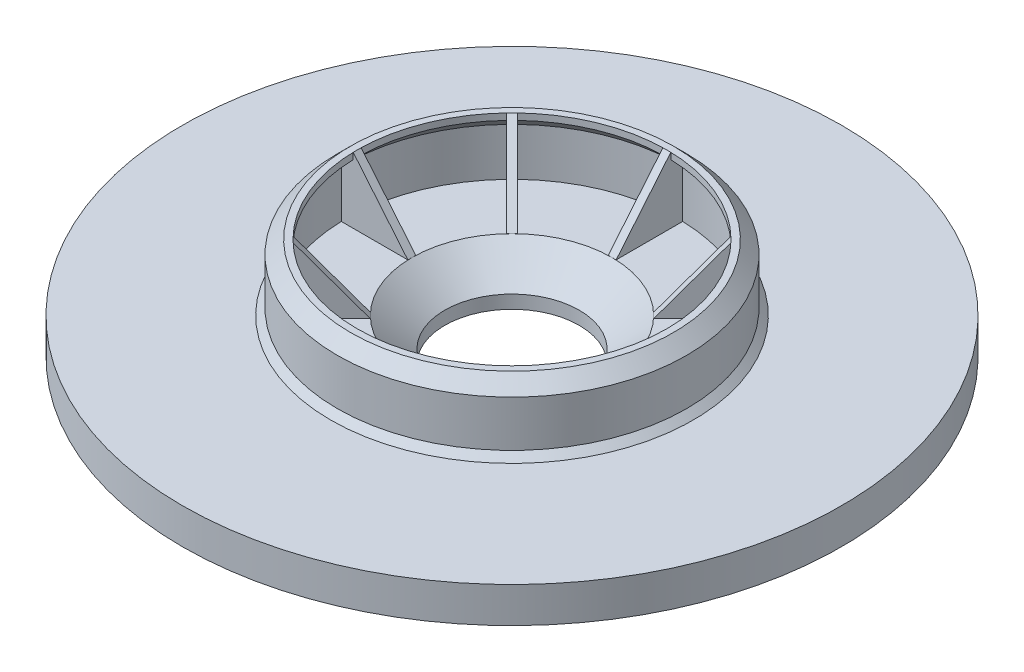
SolidWorks part; units mm, degrees
ref_plane "前视基准面" through (0, 0, 0) normal (0, 0, 1) x (1, 0, 0)
ref_plane "上视基准面" through (0, 0, 0) normal (0, 1, 0) x (1, 0, 0)
ref_plane "右视基准面" through (0, 0, 0) normal (1, 0, 0) x (0, 0, -1)
sketch "草图1" plane through (0, 0, 0) normal (0, 0, 1) x (1, 0, 0)
  line L0 (0, 0) -> (0, 50) construction
  line L1 (-15.2, 1) -> (-15.2, 4)
  line L2 (-16.2, 5) -> (-49, 5)
  line L3 (-23.5, 15.4201) -> (-25.3, 13.6201)
  line L4 (-25.3, 13.6201) -> (-25.3, 6.4)
  line L5 (-26.5, 7.4) -> (-26.5, 14.4)
  line L6 (-50, 6.4) -> (-50, 1)
  line L7 (-50, 6.4) -> (-27.5, 6.4)
  line L8 (-10.2, 0) -> (-14.2, 0)
  line L9 (-50, 1) -> (-49, 1)
  line L10 (-10.2, 0) -> (0, 0) construction
  line L11 (-24.5, 16.4) -> (-23.5, 16.4)
  line L12 (-14.2, 0) -> (-15.2, 1)
  line L13 (-16.2, 5) -> (-15.2, 5) construction
  line L14 (-15.2, 5) -> (-15.2, 4) construction
  line L15 (-23.5, 16.4) -> (-23.5, 15.4201)
  line L16 (-15.2, 4) -> (-16.2, 4)
  line L17 (-16.2, 5) -> (-16.2, 4)
  line L18 (-25.3, 6.4) -> (-15.2, 6.4)
  line L20 (-15.2, 6.4) -> (-10.2, 2)
  line L21 (-10.2, 2) -> (-10.2, 0)
  line L22 (-26.5, 14.4) -> (-24.5, 16.4)
  line L24 (-27.5, 6.4) -> (-26.5, 7.4)
  line L25 (-49, 1) -> (-49, 5)
  point P3 (-15.2, 0)
  point P8 (-26.5, 6.4)
  point P12 (-26.5, 16.4)
  dimension "D1" = 26.5
  dimension "14.6" = 15.2
  dimension "D3" = 1
  dimension "D4" = 10
  dimension "D5" = 50
  dimension "D6" = 2
  dimension "D7" = 5
  dimension "D8" = 3
  dimension "D11" = 1.4
  dimension "D13" = 5
  dimension "D9" = 1
  dimension "D10" = 1
  dimension "D15" = 1.4
  dimension "D16" = 50
  dimension "D17" = 1.4
  dimension "D18" = 1.2
  dimension "D22" = 1
revolve "旋转1" add sketch "草图1" angle 360 about L0
sketch "草图2" plane through (0, 0, 0) normal (0, 0, 1) x (1, 0, 0)
  line L0 (-49, 1) -> (-45, 5)
  line L1 (-49, 1) -> (49, 1) construction
  line L2 (-50, 1) -> (50, 1) construction
  line L3 (-49, 5) -> (49, 5) construction
  dimension "D1" = 45
rib "筋4" sketch "草图2" sketch "草图2" thickness 1.2 extrusion direction parallel to sketch draft on no parameters "D1"=1.2
pattern_circular "阵列(圆周)1" count 16 over 360 about axis through (0, 0, 0) along (0, 1, 0) of "筋4"
sketch "草图3" plane through (0, 0, 0) normal (0, 0, 1) x (1, 0, 0)
  line L0 (-23.5, 16.4) -> (-15.2, 6.4)
  line L1 (23.5, 16.4) -> (-23.5, 16.4) construction
  line L2 (15.2, 6.4) -> (-15.2, 6.4) construction
  line L3 (50, 6.4) -> (-50, 6.4) construction
rib "筋5" sketch "草图3" sketch "草图3" thickness 1.2 extrusion direction parallel to sketch draft on no parameters "D1"=1.2
pattern_circular "阵列(圆周)3" count 8 over 360 about axis through (0, 0, 0) along (0, 1, 0) of "筋5", "旋转1"
sketch "草图5" plane through (0, 0, 0) normal (0, 0, 1) x (1, 0, 0)
  line L0 (-40.1427, 4.79) -> (-39.7327, 4.79)
  line L1 (0, 0) -> (0, 25.4324) construction
  line L2 (-49.9921, 0) -> (-49.9921, 0.79)
  line L3 (-49.9921, 0.79) -> (-49.5821, 0.79)
  line L4 (-49.5821, 0.79) -> (-49.5821, 0)
  line L5 (-49.5821, 0) -> (-49.9921, 0)
  line L6 (-49.3024, 0.79) -> (-48.8924, 0.79)
  line L7 (-49.3024, 0.79) -> (-49.3024, 0)
  line L8 (-49.3024, 0) -> (-48.8924, 0)
  line L9 (-48.8924, 0.79) -> (-48.8924, 0)
  line L10 (-45.1427, 4.79) -> (-44.7327, 4.79)
  line L11 (-45.1427, 4.79) -> (-45.1427, 0)
  line L12 (-45.1427, 0) -> (-44.7327, 0)
  line L13 (-44.7327, 4.79) -> (-44.7327, 0)
  line L14 (-40.1427, 4.79) -> (-40.1427, 0)
  line L15 (-40.1427, 0) -> (-39.7327, 0)
  line L16 (-39.7327, 4.79) -> (-39.7327, 0)
  line L17 (-35.1427, 4.79) -> (-34.7327, 4.79)
  line L18 (-35.1427, 4.79) -> (-35.1427, 0)
  line L19 (-35.1427, 0) -> (-34.7327, 0)
  line L20 (-34.7327, 4.79) -> (-34.7327, 0)
  line L21 (-30.1427, 4.79) -> (-29.7327, 4.79)
  line L22 (-30.1427, 4.79) -> (-30.1427, 0)
  line L23 (-30.1427, 0) -> (-29.7327, 0)
  line L24 (-29.7327, 4.79) -> (-29.7327, 0)
  line L25 (-25.1427, 4.79) -> (-24.7327, 4.79)
  line L26 (-25.1427, 4.79) -> (-25.1427, 0)
  line L27 (-25.1427, 0) -> (-24.7327, 0)
  line L28 (-24.7327, 4.79) -> (-24.7327, 0)
  line L29 (-20.1427, 4.79) -> (-19.7327, 4.79)
  line L30 (-20.1427, 4.79) -> (-20.1427, 0)
  line L31 (-20.1427, 0) -> (-19.7327, 0)
  line L32 (-19.7327, 4.79) -> (-19.7327, 0)
  dimension "D1" = 0.41
  dimension "D2" = 0.79
  dimension "D3" = 0.41
  dimension "D4" = 0.79
  dimension "D5" = 4.79
  dimension "D6" = 0.41
  dimension "D7" = 6
revolve "support" [suppressed] add sketch "草图5" angle 360 about L1
